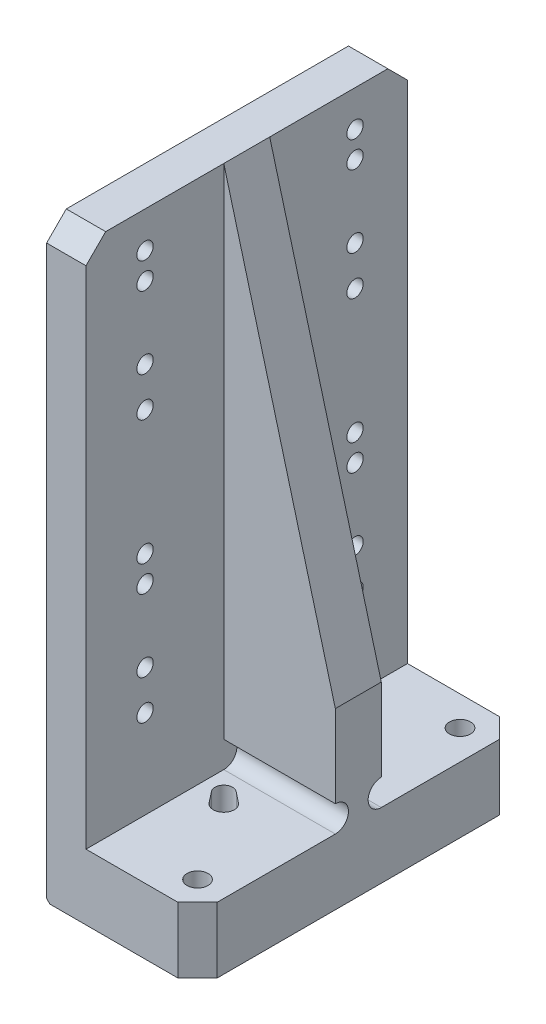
SolidWorks part; units mm, degrees
ref_plane "Front Plane" through (0, 0, 0) normal (0, 0, 1) x (1, 0, 0)
ref_plane "Top Plane" through (0, 0, 0) normal (0, 1, 0) x (1, 0, 0)
ref_plane "Right Plane" through (0, 0, 0) normal (1, 0, 0) x (0, 0, -1)
sketch "Sketch1" plane through (0, 0, 0) normal (0, 1, 0) x (1, 0, 0)
  line L1 (0, -24.5) -> (23, -24.5)
  line L2 (0, -24.5) -> (0, 24.5)
  line L3 (0, 24.5) -> (23, 24.5)
  line L4 (23, -24.5) -> (23, 24.5)
  dimension "D1" = 49
  dimension "D2" = 23
extrude "Extrude1" add sketch "Sketch1" along normal blind 90
hole_wizard "M1.5 (1.5) Diameter Hole1" positions "Sketch3" profile "Sketch2" hole size "M1.5" standard "Ansi Metric"
sketch "Sketch3" plane through (0, 0, 0) normal (0, -1, 0) x (1, 0, 0)
  line L0 (0, -24.5) -> (0, 24.5) construction
  point P0 (2.5, 20)
  point P1 (2.5, -20)
  dimension "D1" = 40
  dimension "D2" = 2.5
  dimension "D3" = 20
sketch "Sketch2" plane through (2.5, 0, 20) normal (1, 0, 0) x (0, 0, -1)
  line L0 (0, 0) -> (0, 3.9506)
  line L1 (0, 3.9506) -> (0.75, 3.5)
  line L2 (0.75, 3.5) -> (0.75, 0)
  line L5 (0.75, 0) -> (0, 0)
  line L10 (0, 3.9506) -> (-0.75, 3.5) construction
  line L11 (0, -6.35) -> (0, 107.95) construction
  dimension "Hole Dia." = 1.5
  dimension "Hole Depth" = 3.5
  dimension "Drill Angle" = 118
hole_wizard "M3x0.5 Tapped Hole4" positions "Sketch12" profile "Sketch11" tap size "M3x0.5" standard "ANSI Metric"
sketch "Sketch12" plane through (0, 0, 0) normal (-1, 0, 0) x (0, 0, 1)
  line L0 (-24.5, 0) -> (24.5, 0) construction
  line L1 (-24.5, 90) -> (-24.5, 0) construction
  line L2 (24.5, 90) -> (24.5, 0) construction
  line L3 (-16.5, 44.5) -> (15.5, 44.5) construction
  line L4 (15.5, 44.5) -> (15.5, 84.5) construction
  line L5 (15.5, 84.5) -> (-16.5, 84.5) construction
  line L6 (-16.5, 84.5) -> (-16.5, 44.5) construction
  point P1 (-16.5, 23.5)
  point P4 (-16.5, 40.5)
  point P7 (-16.5, 63.5)
  point P10 (-16.5, 80.5)
  point P13 (15.5, 23.5)
  point P16 (15.5, 40.5)
  point P19 (15.5, 63.5)
  point P22 (15.5, 80.5)
  point P41 (-16.5, 44.5)
  point P43 (15.5, 44.5)
  point P45 (15.5, 84.5)
  point P47 (-16.5, 84.5)
  point P82 (15.5, 29.5)
  point P84 (-16.5, 29.5)
  point P86 (-16.5, 69.5)
  point P88 (15.5, 69.5)
  dimension "D1" = 23.5
  dimension "D2" = 40.5
  dimension "D3" = 40
  dimension "D4" = 40
  dimension "D5" = 8
  dimension "D6" = 32
  dimension "D7" = 9
  dimension "D8" = 40
  dimension "D9" = 4
  dimension "D10" = 40
  dimension "D11" = 6
sketch "Sketch11" plane through (0, 23.5, -16.5) normal (0, 1, 0) x (0, 0, 1)
  line L0 (0, 0) -> (0, 23)
  line L1 (0, 23) -> (1.25, 23)
  line L2 (1.25, 23) -> (1.25, 0)
  line L5 (1.25, 0) -> (0, 0)
  line L11 (0, -6.35) -> (0, 107.95) construction
  dimension "Thru Tap Drill Dia." = 2.5
  dimension "Thru Tap Drill Depth" = 23
hole_wizard "Ø1.5 (1.5) Diameter Hole1" positions "Sketch8" profile "Sketch7" hole size "Ø1.5" standard "ANSI Metric"
sketch "Sketch8" plane through (0, 0, 0) normal (-1, 0, 0) x (0, 0, 1)
  line L14 (-16.5, 23.5) -> (15.5, 23.5) construction
  line L16 (15.5, 40.5) -> (-16.5, 40.5) construction
  line L18 (-16.5, 63.5) -> (15.5, 63.5) construction
  line L20 (15.5, 80.5) -> (-16.5, 80.5) construction
  line L21 (-16.5, 84.5) -> (-0.5, 84.5) construction
  line L22 (-0.5, 84.5) -> (15.5, 84.5) construction
  line L24 (-16.5, 44.5) -> (-0.5, 44.5) construction
  line L25 (-0.5, 44.5) -> (15.5, 44.5) construction
  line L27 (-16.5, 69.5) -> (-0.5, 69.5) construction
  line L28 (-0.5, 69.5) -> (15.5, 69.5) construction
  line L30 (-16.5, 29.5) -> (-0.4989, 29.5) construction
  line L31 (-0.4989, 29.5) -> (15.5022, 29.5) construction
  point P14 (-0.5, 40.5)
  point P16 (-0.5, 80.5)
  point P31 (-0.5, 23.5)
  point P33 (-0.5, 63.5)
  point P77 (-0.5, 84.5)
  point P79 (-0.5, 69.5)
  point P82 (-0.5, 44.5)
  point P84 (-0.4989, 29.5)
sketch "Sketch7" plane through (0, 40.5, -0.5) normal (0, 1, 0) x (0, 0, 1)
  line L0 (0, 0) -> (0, 3.9506)
  line L1 (0, 3.9506) -> (0.75, 3.5)
  line L2 (0.75, 3.5) -> (0.75, 0)
  line L5 (0.75, 0) -> (0, 0)
  line L10 (0, 3.9506) -> (-0.75, 3.5) construction
  line L11 (0, -6.35) -> (0, 107.95) construction
  dimension "Hole Dia." = 1.5
  dimension "Hole Depth" = 3.5
  dimension "Drill Angle" = 118
sketch "Sketch9" plane through (23, 0, 0) normal (1, 0, 0) x (0, 0, -1)
  line L0 (-24.5, 0) -> (24.5, 0) construction
  line L2 (-24.5, 90) -> (-24.5, 10)
  line L3 (-24.5, 10) -> (24.5, 10)
  line L6 (24.5, 90) -> (-24.5, 90)
  line L7 (24.5, 90) -> (24.5, 10)
  dimension "D1" = 10
extrude "Cut-Extrude4" cut sketch "Sketch9" against normal blind 17
chamfer "Chamfer1" distance 3 angle 45 4 edges at (3, 90, 24.5) (3, 90, -24.5) (23, 5, -24.5) (23, 5, 24.5)
hole_wizard "M3 Clearance Hole1" positions "Sketch14" profile "Sketch13" hole size "M3" standard "ANSI Metric"
sketch "Sketch14" plane through (0, 0, 0) normal (0, -1, 0) x (1, 0, 0)
  line L0 (0, -24.5) -> (0, 24.5) construction
  line L1 (6, 24.5) -> (20, 24.5) construction
  line L2 (0, 24.5) -> (20, 24.5) construction
  point P1 (18.5, 20)
  point P4 (10.5, 8)
  point P7 (10.5, -8)
  point P10 (18.5, -20)
  point P21 (13, 24.5)
  dimension "D1" = 10.5
  dimension "D2" = 18.5
  dimension "D3" = 4.5
  dimension "D4" = 16.5
  dimension "D5" = 32.5
  dimension "D6" = 44.5
sketch "Sketch13" plane through (18.5, 0, 20) normal (1, 0, 0) x (0, 0, -1)
  line L0 (0, 0) -> (0, 90)
  line L1 (0, 90) -> (1.6, 90)
  line L2 (1.6, 90) -> (1.6, 0)
  line L5 (1.6, 0) -> (0, 0)
  line L11 (0, -6.35) -> (0, 107.95) construction
  dimension "Thru Hole Dia." = 3.2
  dimension "Thru Hole Depth" = 90
hole_wizard "M2.5 Clearance Hole1" positions "Sketch17" profile "Sketch16" hole size "M2.5" standard "ANSI Metric"
sketch "Sketch17" plane through (0, 0, 0) normal (0, -1, 0) x (1, 0, 0)
  line L0 (10.5, 8) -> (9, 6.5) construction
  line L1 (9, 6.5) -> (9, -6.5) construction
  line L2 (9, -6.5) -> (10.5, -8) construction
  point P0 (9, 6.5)
  point P2 (9, -6.5)
  dimension "D1" = 13
  dimension "D2" = 135
sketch "Sketch16" plane through (9, 0, 6.5) normal (1, 0, 0) x (0, 0, -1)
  line L0 (0, 0) -> (0, 90)
  line L1 (0, 90) -> (1.35, 90)
  line L2 (1.35, 90) -> (1.35, 0)
  line L5 (1.35, 0) -> (0, 0)
  line L11 (0, -6.35) -> (0, 107.95) construction
  dimension "Thru Hole Dia." = 2.7
  dimension "Thru Hole Depth" = 90
sketch "Sketch15" plane through (0, 0, 0) normal (0, -1, 0) x (1, 0, 0)
  line L0 (9.3686, 9.1314) -> (8.0454, 7.4546)
  line L1 (8.0454, 7.4546) -> (9.9546, 5.5454)
  line L2 (9.9546, 5.5454) -> (11.6314, 6.8686)
  line L3 (11.6314, 6.8686) -> (9.3686, 9.1314)
  line L4 (9.9546, -5.5454) -> (11.6314, -6.8686)
  line L5 (11.6314, -6.8686) -> (9.3686, -9.1314)
  line L6 (9.3686, -9.1314) -> (8.0454, -7.4546)
  line L7 (8.0454, -7.4546) -> (9.9546, -5.5454)
  line L8 (9, 6.5) -> (5.576, 6.5) construction
  line L9 (9, -6.5) -> (6.3384, -6.5) construction
  circle A0 centre (10.5, 8) radius 1.6 construction
  arc A1 (10.3468, -6.4073) -> (8.9073, -7.8468) centre (9, -6.5) ccw construction
  circle A3 centre (10.5, -8) radius 1.6 construction
  arc A4 (8.9073, 7.8468) -> (10.3468, 6.4073) centre (9, 6.5) ccw construction
  arc A5 (10.3468, 6.4073) -> (8.9073, 7.8468) centre (10.5, 8) ccw construction
  point P4 (9, 6.5)
  point P5 (9, -6.5)
  point P9 (10.5, 8)
  point P25 (10.5, -8)
  dimension "D1" = 45
  dimension "D2" = 45
extrude "Cut-Extrude6" cut sketch "Sketch15" against normal up to next
chamfer "Chamfer2" distance 0.5 angle 45 1 edges at (0, 0, 0)
sketch "Sketch18" plane through (6, 0, 0) normal (1, 0, 0) x (0, 0, -1)
  line L0 (21.5, 90) -> (-21.5, 90) construction
  line L1 (-3.5, 90) -> (3.5, 90)
  line L2 (-3.5, 90) -> (-3.5, 14)
  line L3 (-3.5, 10) -> (3.5, 10)
  line L4 (3.5, 90) -> (3.5, 14)
  line L5 (-21.5, 10) -> (21.5, 10) construction
  line L6 (0, 0) -> (0, 10) construction
  arc A0 (-3.5, 10) -> (-3.5, 14) centre (-3.5, 12) ccw
  arc A1 (3.5, 14) -> (3.5, 10) centre (3.5, 12) ccw
  dimension "D2" = 2
  dimension "D1" = 7
extrude "Boss-Extrude1" add sketch "Sketch18" along normal up to surface (17 mm away)
sketch "Sketch19" plane through (0, 0, -3.5) normal (0, 0, -1) x (-1, 0, 0)
  line L0 (-6, 90) -> (-23, 26.5551)
  line L1 (-23, 90) -> (-6, 90) construction
  line L2 (-23, 90) -> (-23, 14) construction
  line L3 (-23, 26.5551) -> (-23, 90)
  line L4 (-23, 90) -> (-6, 90)
  dimension "D1" = 15
extrude "Cut-Extrude7" cut sketch "Sketch19" against normal through all
sketch "Sketch23" plane through (0, 0, 0) normal (-1, 0, 0) x (0, 0, 1)
  line L0 (24.5, 87) -> (24.5, 0.5) construction
  line L1 (15.5, 84.5) -> (24.5, 84.5) construction
  line L2 (15.5, 29.5) -> (24.5, 29.5) construction
  circle A0 centre (24.5, 29.5) radius 0.5
  circle A1 centre (24.5, 44.5) radius 0.5
  circle A2 centre (24.5, 69.5) radius 0.5
  circle A3 centre (24.5, 84.5) radius 0.5
  dimension "D1" = 1
  dimension "D2" = 40
  dimension "D3" = 40
extrude "Cut-Extrude8" [suppressed] cut sketch "Sketch23" against normal blind 0.5
